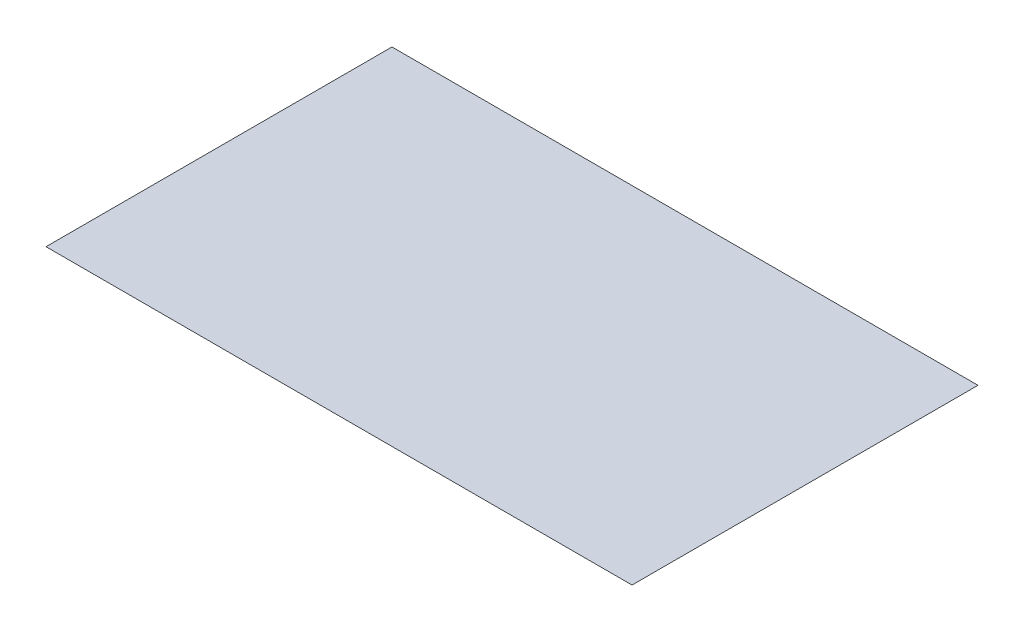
SolidWorks part; units mm, degrees
ref_plane "Front Plane" through (0, 0, 0) normal (0, 0, 1) x (1, 0, 0)
ref_plane "Top Plane" through (0, 0, 0) normal (0, 1, 0) x (1, 0, 0)
ref_plane "Right Plane" through (0, 0, 0) normal (1, 0, 0) x (0, 0, -1)
sketch "Sketch2" plane through (0, 0, 0) normal (0, 1, 0) x (1, 0, 0)
  line L1 (-85.5306, 46.8636) -> (99.7857, 46.8636)
  line L2 (-85.5306, 46.8636) -> (-85.5306, -62.5443)
  line L3 (-85.5306, -62.5443) -> (99.7857, -62.5443)
  line L4 (99.7857, 46.8636) -> (99.7857, -62.5443)
surface "Surface-Plane1" sketch "Sketch2"
